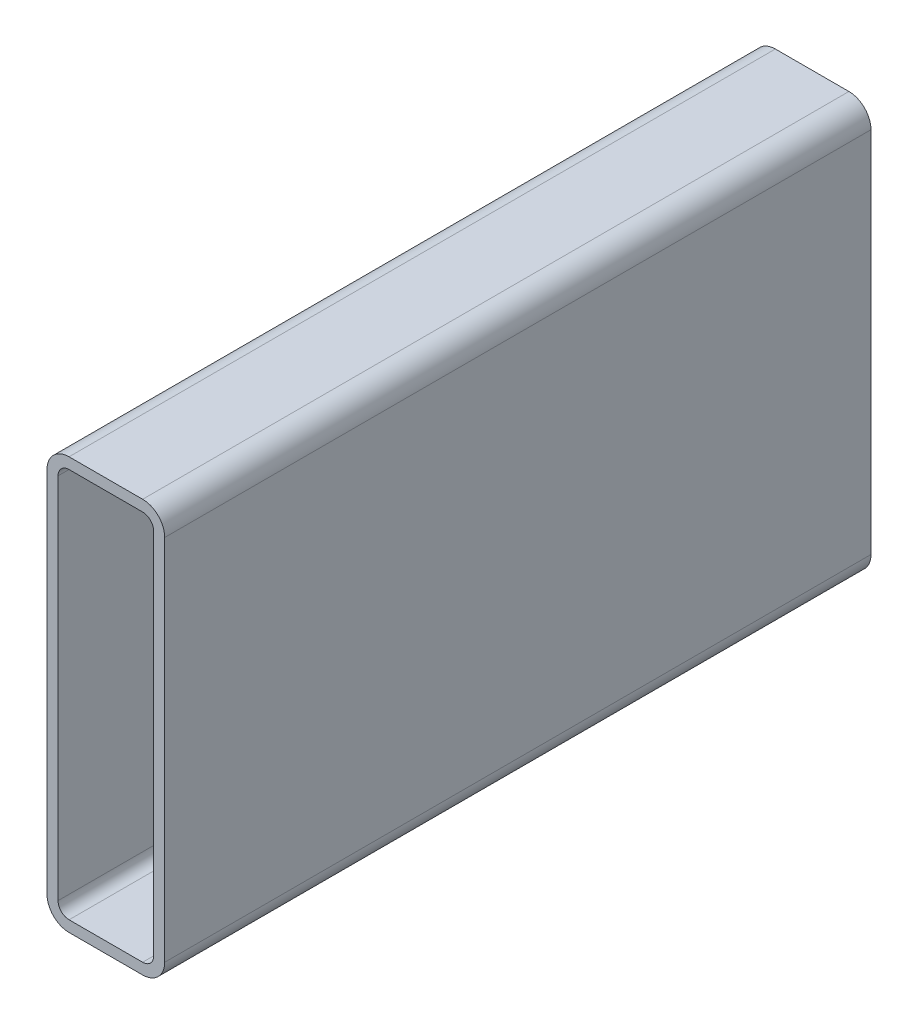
SolidWorks part; units mm, degrees
ref_plane "Front Plane" through (0, 0, 0) normal (0, 0, 1) x (1, 0, 0)
ref_plane "Top Plane" through (0, 0, 0) normal (0, 1, 0) x (1, 0, 0)
ref_plane "Right Plane" through (0, 0, 0) normal (1, 0, 0) x (0, 0, -1)
sketch "Sketch1" plane through (0, 0, 0) normal (0, 0, 1) x (1, 0, 0)
  line B0 (9.525, 177.8) -> (41.275, 177.8)
  arc B1 (50.8, 168.275) -> (41.275, 177.8) centre (41.275, 168.275) ccw
  line B2 (50.8, 168.275) -> (50.8, 9.525)
  arc B3 (41.275, 0) -> (50.8, 9.525) centre (41.275, 9.525) ccw
  line B4 (41.275, 0) -> (9.525, 0)
  arc B5 (0, 9.525) -> (9.525, 0) centre (9.525, 9.525) ccw
  line B6 (0, 9.525) -> (0, 168.275)
  arc B7 (9.525, 177.8) -> (0, 168.275) centre (9.525, 168.275) ccw
  line B8 (9.525, 173.0375) -> (41.275, 173.0375)
  arc B9 (46.0375, 168.275) -> (41.275, 173.0375) centre (41.275, 168.275) ccw
  line B10 (46.0375, 168.275) -> (46.0375, 9.525)
  arc B11 (41.275, 4.7625) -> (46.0375, 9.525) centre (41.275, 9.525) ccw
  line B12 (41.275, 4.7625) -> (9.525, 4.7625)
  arc B13 (4.7625, 9.525) -> (9.525, 4.7625) centre (9.525, 9.525) ccw
  line B14 (4.7625, 9.525) -> (4.7625, 168.275)
  arc B15 (9.525, 173.0375) -> (4.7625, 168.275) centre (9.525, 168.275) ccw
sketch_block_instance "HSS7x2x0.1875-1"
sketch_block "HSS7x2x0.1875"
extrude "Boss-Extrude1" add sketch "Sketch1" along normal blind 304.8
